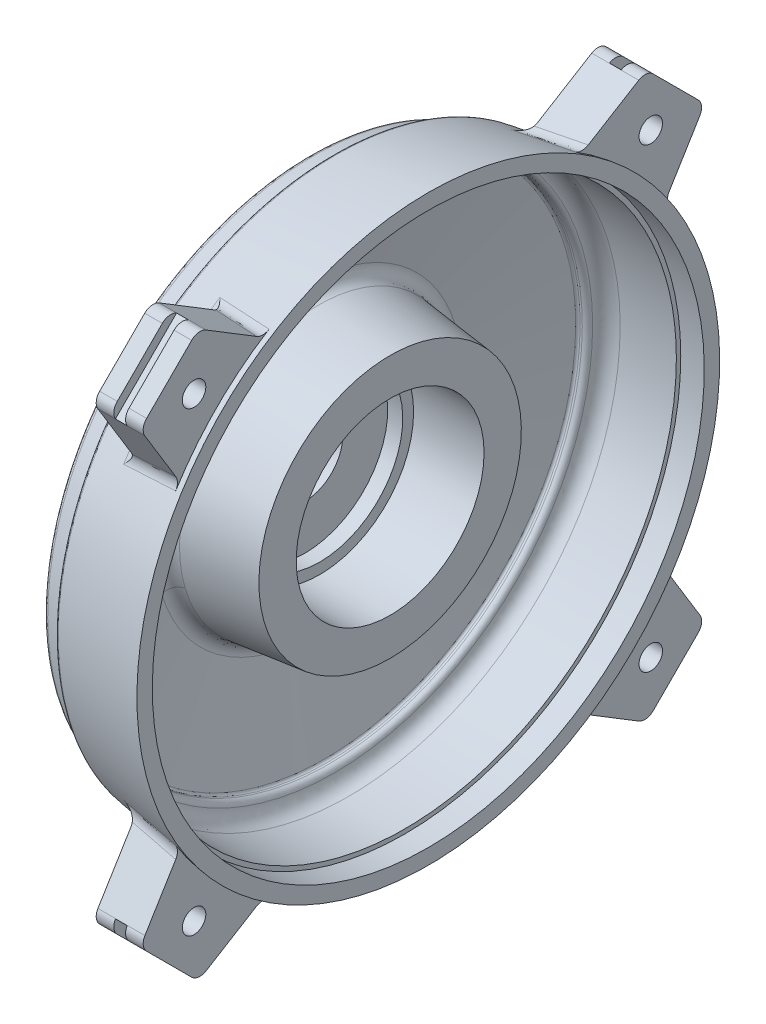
SolidWorks part; units mm, degrees
ref_plane "Plan de face" through (0, 0, 0) normal (0, 0, 1) x (1, 0, 0)
ref_plane "Plan de dessus" through (0, 0, 0) normal (0, 1, 0) x (1, 0, 0)
ref_plane "Plan de droite" through (0, 0, 0) normal (1, 0, 0) x (0, 0, -1)
imported_body "Importée1"
sketch "Esquisse1" plane through (-112.5, 0, 0) normal (1, 0, 0) x (0, 0, -1)
  circle A0 centre (0, 0) radius 16
  circle A1 centre (0, 0) radius 16.2505 construction
  circle A2 centre (0, 0) radius 16.2505
  dimension "D1" = 32
extrude "Boss.-Extru.1" add sketch "Esquisse1" against normal up to surface (12 mm away)
sketch "Esquisse2" plane through (0, 43.1335, -43.1335) normal (0, 0.7071, -0.7071) x (1, 0, 0)
  line L0 (-107, -5.4264) -> (-107, 5.4264) construction
  line L1 (-112, 10.1069) -> (-110, 10.1069)
  line L2 (-112, 10.1069) -> (-112, -9.8931)
  line L3 (-112, -9.8931) -> (-110, -9.8931)
  line L4 (-110, 10.1069) -> (-110, -9.8931)
  dimension "D1" = 3
  dimension "D2" = 20
  dimension "D3" = 2
extrude "Enlèv. mat.-Extru.1" cut sketch "Esquisse2" against normal blind 1.5
pattern_circular "Répétition circulaire1" count 4 over 360 about axis through (0, 0, 0) along (1, 0, 0) of "Enlèv. mat.-Extru.1"
sketch "Esquisse3" plane through (-106, 0, 0) normal (1, 0, 0) x (0, 0, -1)
  circle A0 centre (0, 0) radius 47 construction
  circle A1 centre (0, 0) radius 47
  circle A2 centre (0, 0) radius 46.2497
extrude "Enlèv. mat.-Extru.2" cut sketch "Esquisse3" against normal blind 4
